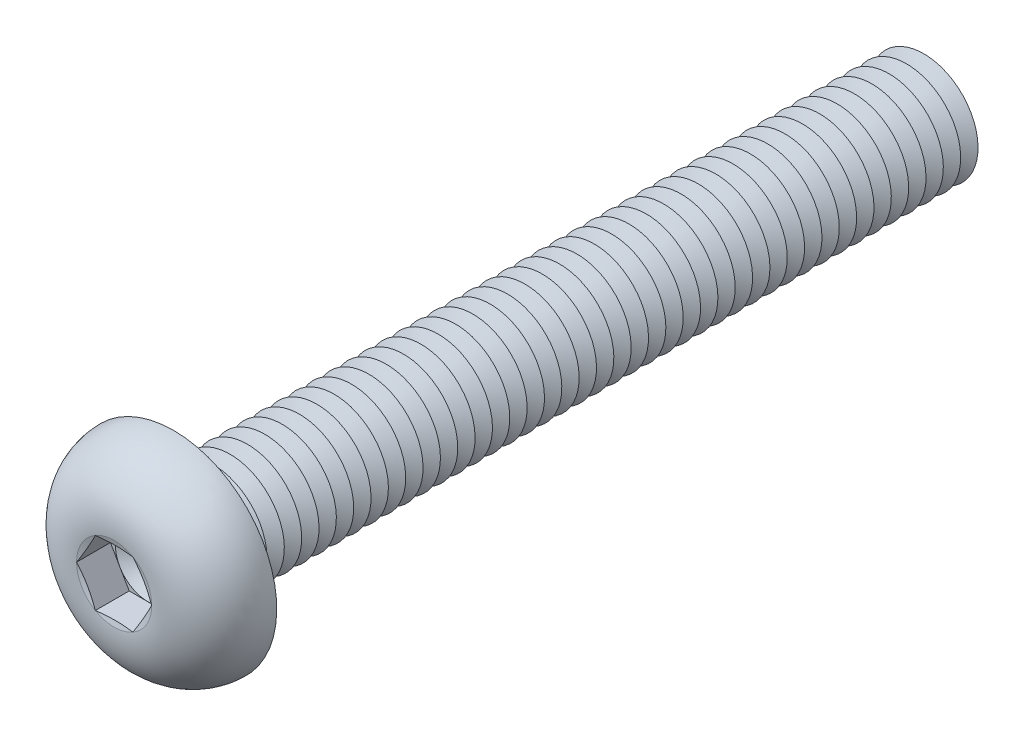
SolidWorks part; units mm, degrees
ref_plane "Front Plane" through (0, 0, 0) normal (0, 0, 1) x (1, 0, 0)
ref_plane "Top Plane" through (0, 0, 0) normal (0, 1, 0) x (1, 0, 0)
ref_plane "Right Plane" through (0, 0, 0) normal (1, 0, 0) x (0, 0, -1)
sketch "Sketch1" plane through (0, 0, 0) normal (1, 0, 0) x (0, 0, -1)
  line L0 (0, 2.5) -> (0, 4.75)
  line L3 (0, 2.5) -> (35, 2.5)
  line L4 (35, 2.5) -> (35, 0)
  line L5 (35, 0) -> (-2.75, 0) construction
  line L6 (-2.75, 0) -> (35, 0)
  line L7 (-2.75, 1.732) -> (-2.75, 0.866) construction
  line L8 (-2.75, 0.866) -> (-2.75, 0)
  line L9 (-2.75, 1.732) -> (-2.5179, 0.866)
  line L10 (-2.5179, 0.866) -> (-2.75, 0.866)
  line L11 (35, 0) -> (22.7481, 0) construction
  line L12 (0, 4.75) -> (-2.75, 4.75) construction
  arc A1 (0, 4.75) -> (-2.75, 1.732) centre (0, 1.9881) ccw
  point P8 (35, 1.25)
  dimension "D1" = 9.5
  dimension "D2" = 5
  dimension "D3" = 2.75
  dimension "D4" = 3.4641
  dimension "D5" = 35
  dimension "D6" = 15
revolve "Revolve1" add sketch "Sketch1" angle 360 about L5
fillet "Fillet1" radius 0.4 1 edges at (0, 2.5, 0)
sketch "Sketch2" plane through (0, 0, 0) normal (1, 0, 0) x (0, 0, -1)
  line L0 (34.6, 2.5) -> (35.4, 2.5)
  line L1 (35, 2.5) -> (0.4, 2.5) construction
  line L2 (35.4, 2.5) -> (35, 1.8072)
  line L3 (35, -2.5) -> (35, 2.5) construction
  line L4 (35, 1.8072) -> (34.6, 2.5)
  dimension "D1" = 0.8
revolve "Cut-Revolve1" cut sketch "Sketch2" angle 360 about axis through (0, 0, -35) along (0, 0, -1)
pattern_linear "LPattern1" count 43 spacing 0.8 along (0, 0, 1) of "Cut-Revolve1"
sketch "Sketch3" plane through (0, 0, 2.75) normal (0, 0, 1) x (1, 0, 0)
  line L7 (0.866, 1.5) -> (-0.866, 1.5)
  line L8 (-0.866, 1.5) -> (-1.7321, 0)
  line L9 (-1.7321, 0) -> (-0.866, -1.5)
  line L10 (-0.866, -1.5) -> (0.866, -1.5)
  line L11 (0.866, -1.5) -> (1.7321, 0)
  line L12 (1.7321, 0) -> (0.866, 1.5)
  circle A0 centre (0, 0) radius 1.5 construction
  circle A3 centre (0, 0) radius 1.732 construction
extrude "Cut-Extrude1" cut sketch "Sketch3" against normal blind 1.56
sketch "Sketch4" plane through (0, 0, 1.19) normal (0, 0, 1) x (1, 0, 0)
  line L1 (0.866, 1.5) -> (-0.866, 1.5) construction
  circle A0 centre (0, 0) radius 1.5
extrude "Cut-Extrude2" cut sketch "Sketch4" against normal through all draft 60
